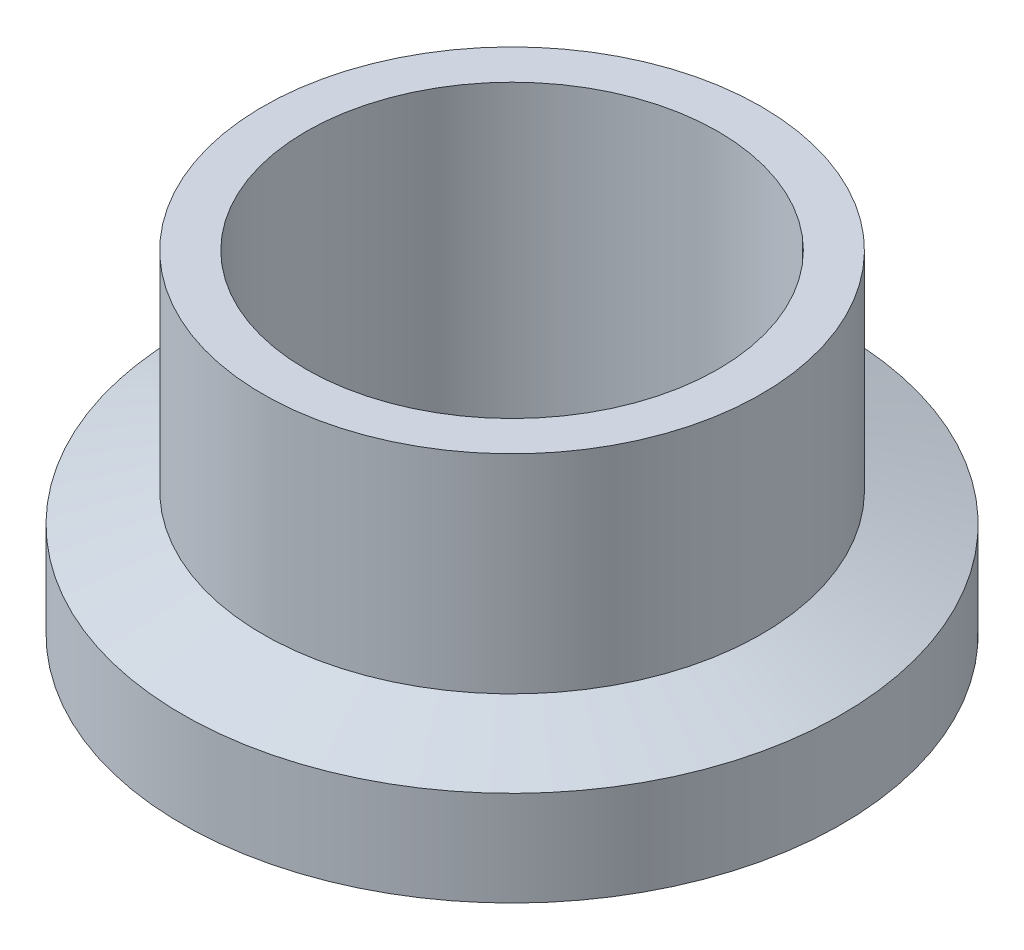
SolidWorks part; units mm, degrees
ref_plane "Front Plane" through (0, 0, 0) normal (0, 0, 1) x (1, 0, 0)
ref_plane "Top Plane" through (0, 0, 0) normal (0, 1, 0) x (1, 0, 0)
ref_plane "Right Plane" through (0, 0, 0) normal (1, 0, 0) x (0, 0, -1)
sketch "Sketch1" plane through (0, 0, 0) normal (0, 0, 1) x (1, 0, 0)
  line L0 (-7.874, 0.889) -> (-7.874, 12.7)
  line L1 (-7.874, 12.7) -> (-9.525, 12.7)
  line L2 (-9.525, 12.7) -> (-9.525, 4.7508)
  line L3 (-9.525, 4.7508) -> (-12.5984, 3.6322)
  line L4 (-12.5984, 3.6322) -> (-12.5984, 0)
  line L5 (-12.5984, 0) -> (-10.922, 0)
  line L6 (-10.922, 0) -> (-10.922, 1.3208)
  line L7 (0, 0) -> (0, 14.3564) construction
  line L9 (-8.6024, 0.889) -> (-7.874, 0.889)
  line L10 (-9.5843, 1.853) -> (-8.6024, 0.889)
  arc A2 (-9.5843, 1.853) -> (-10.922, 1.3208) centre (-10.1473, 1.3208) ccw
  dimension "D7" = 10.1473
  dimension "D1" = 12.7
  dimension "D2" = 3.6322
  dimension "D3" = 110
  dimension "D4" = 7.874
  dimension "D5" = 9.525
  dimension "D6" = 11.811
  dimension "D8" = 10.922
  dimension "D9" = 12.5984
revolve "Revolve1" add sketch "Sketch1" angle 360 about L7
